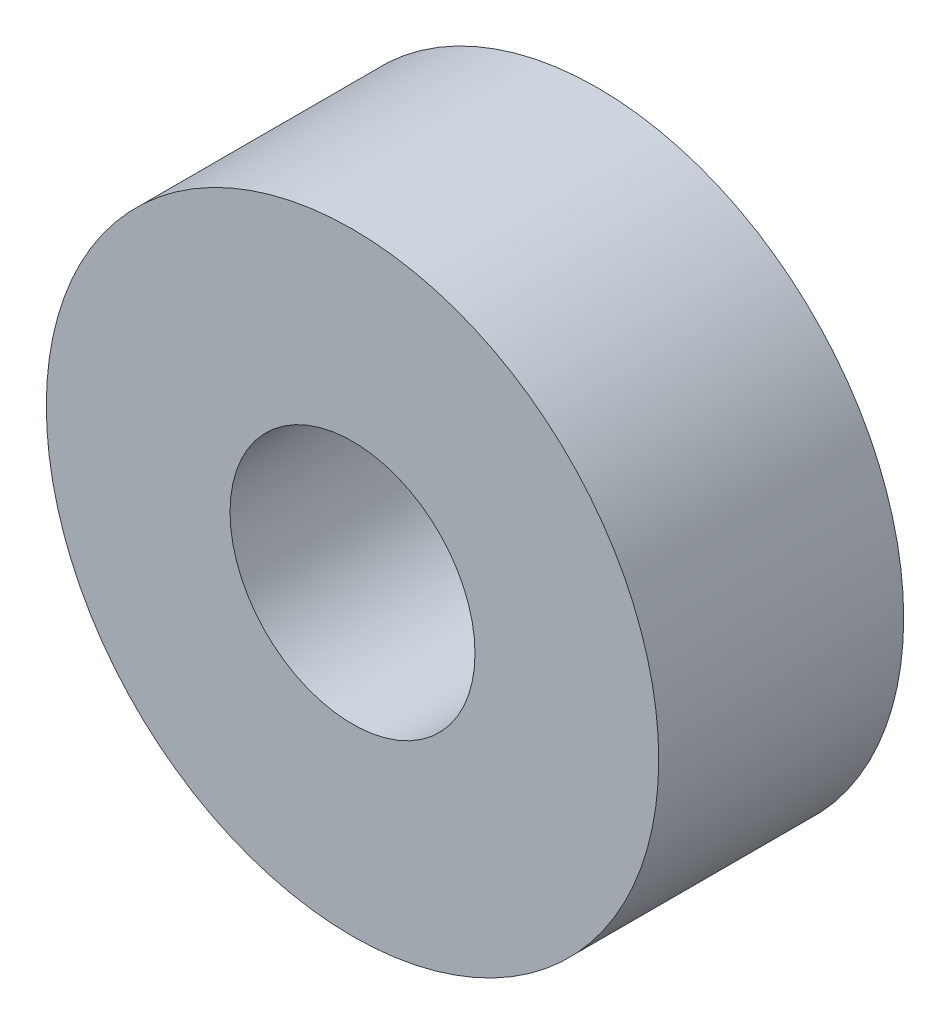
SolidWorks part; units mm, degrees
ref_plane "Ebene vorne" through (0, 0, 0) normal (0, 0, 1) x (1, 0, 0)
ref_plane "Ebene oben" through (0, 0, 0) normal (0, 1, 0) x (1, 0, 0)
ref_plane "Ebene rechts" through (0, 0, 0) normal (1, 0, 0) x (0, 0, -1)
sketch "Skizze1" plane through (0, 0, 0) normal (0, 0, 1) x (1, 0, 0)
  circle A0 centre (0, 0) radius 25
  circle A1 centre (0, 0) radius 10
  dimension "D1" = 50
  dimension "D2" = 20
extrude "Linear austragen1" add sketch "Skizze1" along normal blind 20
equation "\"LÄNGE\"=0"
equation "\"BREITE\"=0"
equation "\"HÖHE\"=0"
equation "\"DURCHMESSER\"=0"
equation "\"Stückzahl\"= 1"
